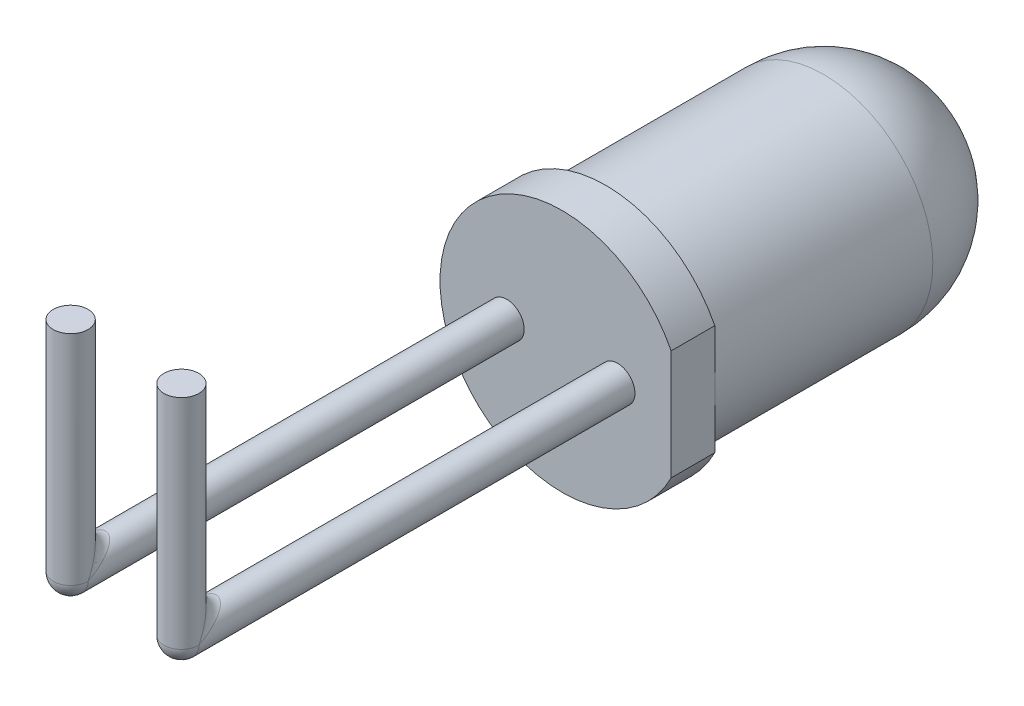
SolidWorks part; units mm, degrees
ref_plane "Face" through (0, 0, 0) normal (0, 0, 1) x (1, 0, 0)
ref_plane "Dessus" through (0, 0, 0) normal (0, 1, 0) x (1, 0, 0)
ref_plane "Droite" through (0, 0, 0) normal (1, 0, 0) x (0, 0, -1)
sketch "Esquisse1" plane through (0, 0, 0) normal (0, 0, 1) x (1, 0, 0)
  circle A0 centre (0, 0) radius 2.5
extrude "Base-Extrusion" add sketch "Esquisse1" along normal blind 8.5
sketch "Esquisse2" plane through (0, 0, 8.5) normal (0, 0, 1) x (1, 0, 0)
  line L0 (2.5, -2.4917) -> (2.5, 2.5621) construction
  line L1 (2.5, 1.261) -> (2.5, -1.261)
  arc A0 (2.5, 1.261) -> (2.5, -1.261) centre (0, 0) ccw
extrude "Boss.-Extru.1" add sketch "Esquisse2" against normal blind 1
fillet "Congé1" radius 2.5 1 edges at (2.5, 0, 0)
sketch "Esquisse3" plane through (0, 0, 8.5) normal (0, 0, 1) x (1, 0, 0)
  line L0 (0, 1.4329) -> (0, -0.9388) construction
  circle A0 centre (1.27, 0) radius 0.4
  circle A1 centre (-1.27, 0) radius 0.4
ref_plane "Plan1" through (0, 0, 0) normal (1, 0, 0) x (0, 0, -1)
sketch "Esquisse4" plane through (0, 0, 0) normal (1, 0, 0) x (0, 0, -1)
  line L0 (-8.5, 0) -> (-18.5, 0)
  line L1 (-8.5, 0.4) -> (-8.5, -0.4) construction
  line L2 (-18.5, 0) -> (-18.5, 5)
  dimension "D1" = 10
  dimension "D2" = 5
sweep "Balayage1" add profiles "Esquisse3" path "Esquisse4"
fillet "Congé2" radius 0.4 2 edges at (1.27, 0.4, 18.1) (-1.27, 0.4, 18.1)
